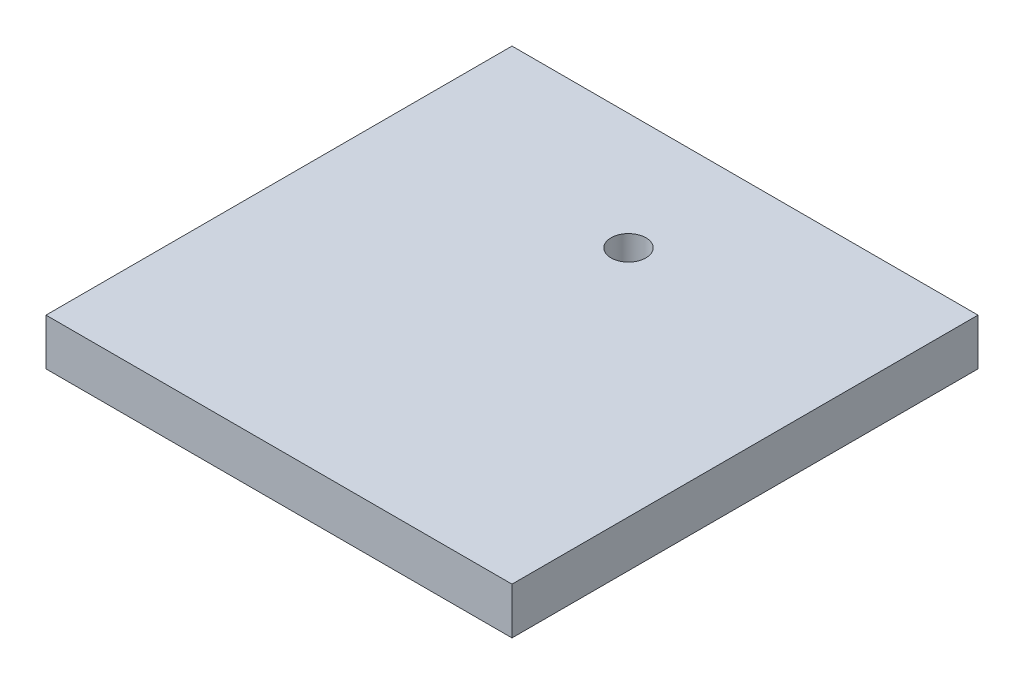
SolidWorks part; units mm, degrees
ref_plane "Front Plane" through (0, 0, 0) normal (0, 0, 1) x (1, 0, 0)
ref_plane "Top Plane" through (0, 0, 0) normal (0, 1, 0) x (1, 0, 0)
ref_plane "Right Plane" through (0, 0, 0) normal (1, 0, 0) x (0, 0, -1)
sketch "Sketch1" plane through (0, 0, 0) normal (0, 1, 0) x (1, 0, 0)
  line L1 (0, 0) -> (100, 0)
  line L2 (0, 0) -> (0, 100)
  line L3 (0, 100) -> (100, 100)
  line L4 (100, 0) -> (100, 100)
  dimension "D1" = 100
  dimension "D2" = 100
extrude "Extrude1" add sketch "Sketch1" along normal blind 10
hole_wizard "Ø7.5 (7.5) Diameter Hole2" positions "3DSketch1" profile "Sketch2" hole size "Ø7.5" standard "ANSI Metric"
sketch3d "3DSketch1"
  line L0 (0, 10, -100) -> (0, 10, 0) construction
  line L1 (100, 10, -100) -> (0, 10, -100) construction
  point P0 (50, 10, -75)
  dimension "D1" = 50
  dimension "D2" = 25
sketch "Sketch2" plane through (50, 10, -75) normal (1, 0, 0) x (0, 0, 1)
  line L0 (0, 0) -> (0, 10.2532)
  line L1 (0, 10.2532) -> (3.75, 8)
  line L2 (3.75, 8) -> (3.75, 0)
  line L5 (3.75, 0) -> (0, 0)
  line L10 (0, 10.2532) -> (-3.75, 8) construction
  line L11 (0, -6.35) -> (0, 107.95) construction
  dimension "Hole Dia." = 7.5
  dimension "Hole Depth" = 8
  dimension "Drill Angle" = 118
